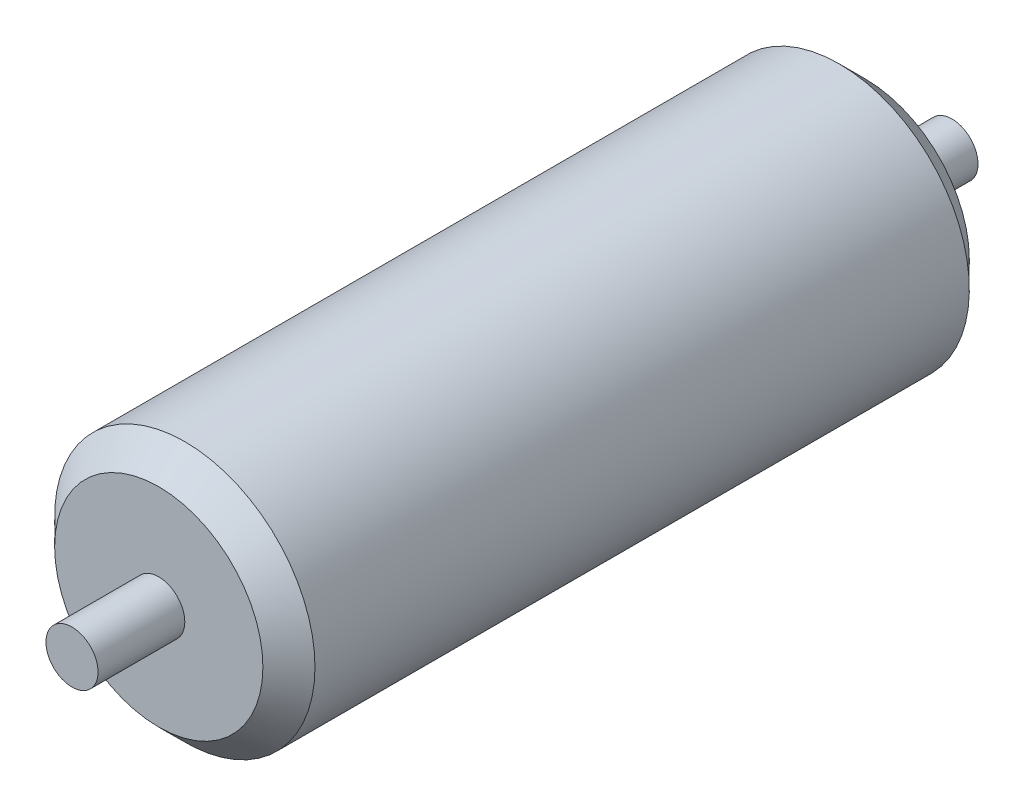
SolidWorks part; units mm, degrees
ref_plane "前视基准面" through (0, 0, 0) normal (0, 0, 1) x (1, 0, 0)
ref_plane "上视基准面" through (0, 0, 0) normal (0, 1, 0) x (1, 0, 0)
ref_plane "右视基准面" through (0, 0, 0) normal (1, 0, 0) x (0, 0, -1)
sketch "草图1" plane through (0, 0, 0) normal (0, 0, 1) x (1, 0, 0)
  circle A0 centre (0, 0) radius 150
  dimension "D1" = 300
extrude "拉伸1" add sketch "草图1" along normal mid plane 754
sketch "草图2" plane through (0, 0, 0) normal (1, 0, 0) x (0, 0, -1)
  line L0 (-377, 0) -> (-407, 0)
  line L1 (-377, 150) -> (-377, -150) construction
  line L2 (-407, 0) -> (-407, 120)
  line L3 (-407, 120) -> (-377, 150)
  line L4 (-377, 150) -> (-377, 0)
  dimension "D1" = 30
  dimension "D2" = 120
revolve "旋转1" add sketch "草图2" angle 360 about L0
mirror "镜向1" about plane through (0, 0, 0) normal (0, 0, 1) of "旋转1"
sketch "草图3" plane through (0, 0, 407) normal (0, 0, 1) x (1, 0, 0)
  circle A0 centre (0, 0) radius 30
  dimension "D1" = 60
extrude "拉伸2" add sketch "草图3" along normal blind 100
mirror "镜向2" about plane through (0, 0, 0) normal (0, 0, 1) of "拉伸2"
